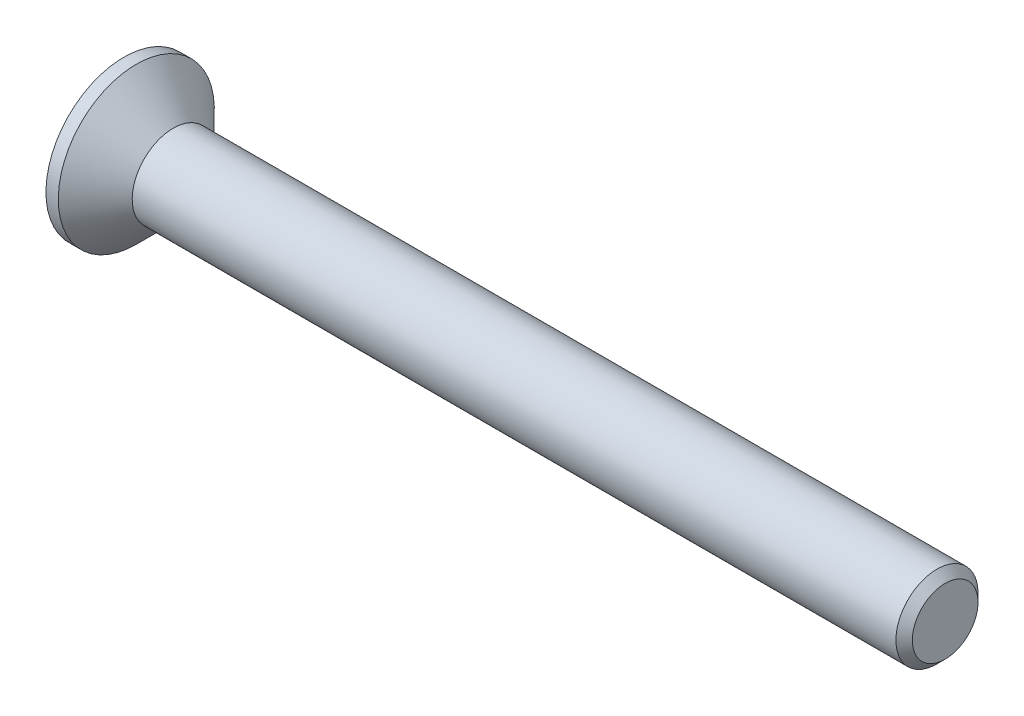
SolidWorks part; units mm, degrees
ref_plane "Front Plane" through (0, 0, 0) normal (0, 0, 1) x (1, 0, 0)
ref_plane "Top Plane" through (0, 0, 0) normal (0, 1, 0) x (1, 0, 0)
ref_plane "Right Plane" through (0, 0, 0) normal (1, 0, 0) x (0, 0, -1)
sketch "Sketch1" plane through (0, 0, 0) normal (0, 0, 1) x (1, 0, 0)
  line L1 (-1.2, 1.9) -> (-1.2, 0)
  line L2 (-1.2, 0) -> (18.8, 0)
  line L3 (18.8, 0) -> (18.8, 1)
  line L4 (18.8, 1) -> (0, 1)
  line L5 (-1.2, 1.9) -> (-0.9, 1.9)
  line L6 (-0.9, 1.9) -> (0, 1)
  dimension "D1" = 1
  dimension "D2" = 45
  dimension "D3" = 1.2
  dimension "D4" = 20
  dimension "D5" = 1.9
revolve "Revolve1" add sketch "Sketch1" angle 360 about L2
chamfer "Chamfer1" distance 0.2 angle 45 1 edges at (18.8, -1, 0)
sketch "Sketch2" plane through (-1.2, 0, 0) normal (-1, 0, 0) x (0, 0, 1)
  line L0 (-0.3, 1.175) -> (0.3, 1.175)
  line L1 (0.3, 1.175) -> (0.3, 0.3)
  line L2 (0.3, 0.3) -> (1.175, 0.3)
  line L3 (1.175, 0.3) -> (1.175, -0.3)
  line L4 (1.175, -0.3) -> (0.3, -0.3)
  line L5 (0.3, -0.3) -> (0.3, -1.175)
  line L6 (0.3, -1.175) -> (-0.3, -1.175)
  line L7 (-0.3, -1.175) -> (-0.3, -0.3)
  line L8 (-0.3, -0.3) -> (-1.175, -0.3)
  line L9 (-1.175, -0.3) -> (-1.175, 0.3)
  line L10 (-1.175, 0.3) -> (-0.3, 0.3)
  line L11 (-0.3, 0.3) -> (-0.3, 1.175)
  point P5 (0, 1.175)
  point P13 (1.175, 0)
  point P15 (-1.175, 0)
  point P16 (0, -1.175)
  point P17 (0.3, 1.085)
  dimension "D1" = 0.6
  dimension "D2" = 2.35
extrude "Cut-Extrude1" cut sketch "Sketch2" against normal blind 0.95
